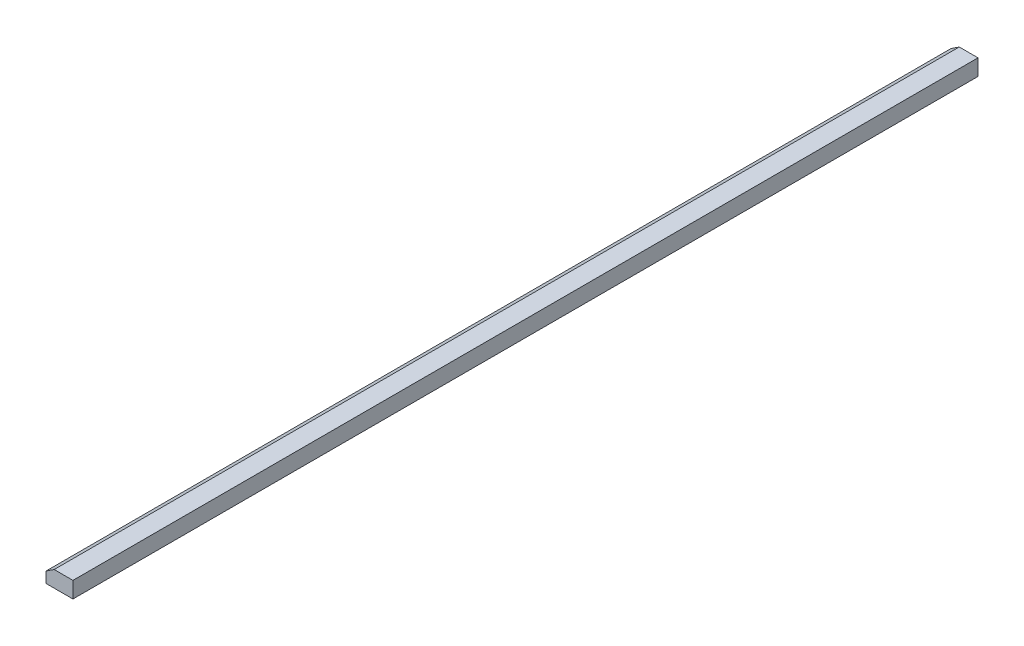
SolidWorks part; units mm, degrees
ref_plane "Face" through (0, 0, 0) normal (0, 0, 1) x (1, 0, 0)
ref_plane "Dessus" through (0, 0, 0) normal (0, 1, 0) x (1, 0, 0)
ref_plane "Droite" through (0, 0, 0) normal (1, 0, 0) x (0, 0, -1)
sketch "Esquisse1" plane through (0, 0, 0) normal (0, 0, 1) x (1, 0, 0)
  line L1 (0, 3.4219) -> (25, 3.4219)
  line L2 (25, 18.4219) -> (7.5652, 18.4219)
  line L3 (0, 13.4172) -> (7.5652, 18.4219)
  line L4 (25, 3.4219) -> (25, 18.4219)
  line L5 (0, 3.4219) -> (0, 13.4172)
  dimension "D1" = 15
  dimension "D2" = 25
  dimension "D3" = 33.486
  dimension "D4" = 9.9953
  dimension "D5" = 17.4348
extrude "Extrusion1" add sketch "Esquisse1" along normal blind 840
